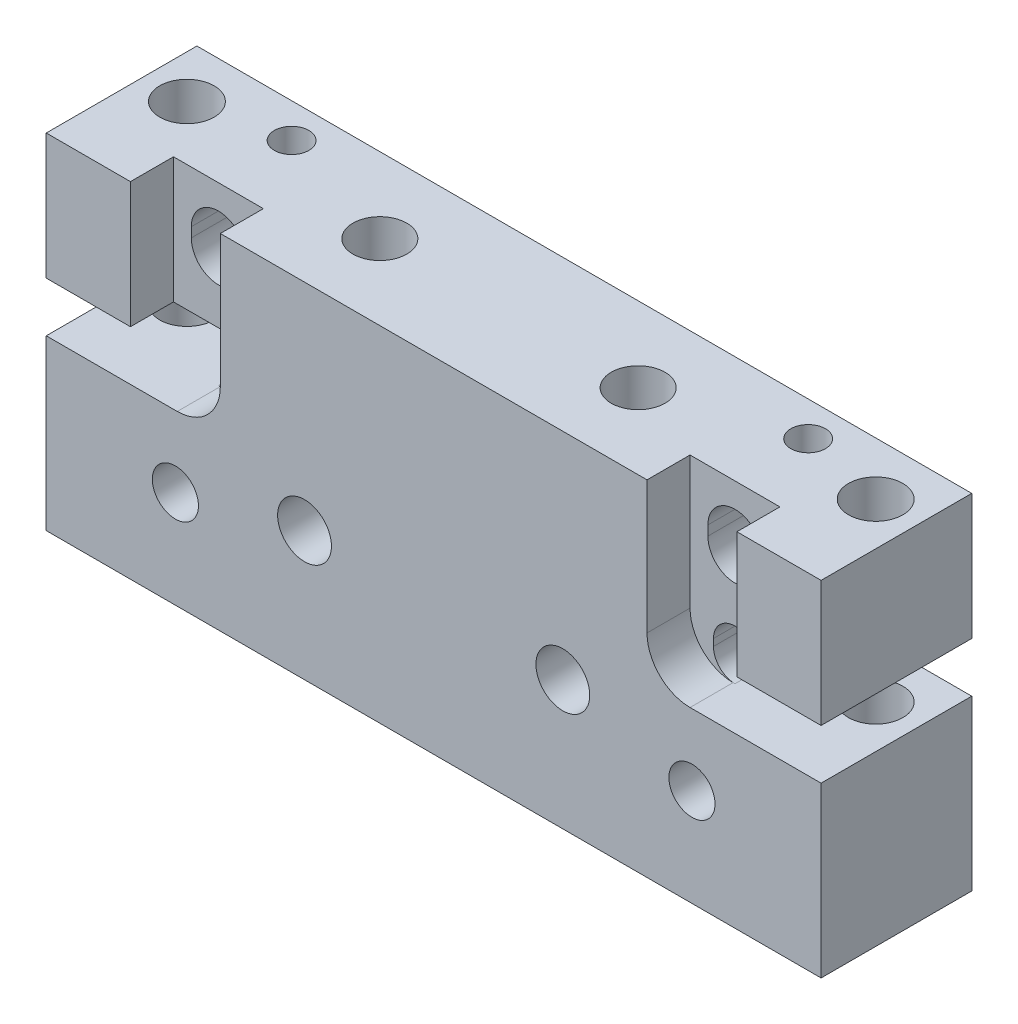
SolidWorks part; units mm, degrees
ref_plane "Front Plane" through (0, 0, 0) normal (0, 0, 1) x (1, 0, 0)
ref_plane "Top Plane" through (0, 0, 0) normal (0, 1, 0) x (1, 0, 0)
ref_plane "Right Plane" through (0, 0, 0) normal (1, 0, 0) x (0, 0, -1)
sketch "Sketch1" plane through (0, 0, 0) normal (0, 0, 1) x (1, 0, 0)
  line L1 (0, 0) -> (114.3, 0)
  line L2 (0, 0) -> (0, 50.8)
  line L3 (0, 50.8) -> (114.3, 50.8)
  line L4 (114.3, 0) -> (114.3, 50.8)
  dimension "D1" = 114.3
  dimension "D2" = 50.8
extrude "Extrude1" add sketch "Sketch1" along normal blind 22.225
ref_plane "Plane1" through (0, 31.75, 0) normal (0, -1, 0) x (1, 0, 0)
ref_plane "Plane2" through (0, 25.4, 0) normal (0, -1, 0) x (1, 0, 0)
sketch "Sketch2" plane through (0, 0, 22.225) normal (0, 0, 1) x (1, 0, 0)
  line L0 (57.15, 50.8) -> (57.15, 0) construction
  line L1 (114.3, 50.8) -> (0, 50.8) construction
  line L2 (0, 0) -> (114.3, 0) construction
  line L3 (17.2861, 28.575) -> (95.7792, 28.575) construction
  line L4 (-12.2238, 31.75) -> (12.2238, 31.75) construction
  line L5 (114.3, 0) -> (114.3, 50.8) construction
  line L6 (114.3, 32.258) -> (95.25, 32.258)
  line L7 (114.3, 32.258) -> (114.3, 24.892)
  line L8 (114.3, 24.892) -> (95.25, 24.892)
  line L9 (92.075, 29.083) -> (92.075, 28.067)
  line L10 (22.225, 29.083) -> (22.225, 28.067)
  line L11 (0, 24.892) -> (19.05, 24.892)
  line L12 (0, 32.258) -> (0, 24.892)
  line L13 (0, 32.258) -> (19.05, 32.258)
  arc A0 (22.225, 29.083) -> (19.05, 32.258) centre (19.05, 29.083) ccw
  arc A1 (19.05, 24.892) -> (22.225, 28.067) centre (19.05, 28.067) ccw
  arc A2 (92.075, 28.067) -> (95.25, 24.892) centre (95.25, 28.067) ccw
  arc A3 (92.075, 29.083) -> (95.25, 32.258) centre (95.25, 29.083) cw
  point P22 (22.225, 32.258)
  point P25 (22.225, 24.892)
  point P28 (92.075, 24.892)
  point P31 (92.075, 32.258)
  dimension "D4" = 3.175
  dimension "D5" = 3.175
  dimension "D1" = 3.175
  dimension "D2" = 7.366
  dimension "D3" = 22.225
extrude "Clearance Slot" cut sketch "Sketch2" against normal through all
hole_wizard "M8x1.25 Tapped Hole1" positions "Sketch5" profile "Sketch6" tap size "M8x1.25" standard "Ansi Metric"
sketch "Sketch5" plane through (0, 0, 22.225) normal (0, 0, 1) x (1, 0, 0)
  line L0 (57.15, 0) -> (57.15, 50.8) construction
  line L1 (0, 0) -> (114.3, 0) construction
  line L2 (114.3, 50.8) -> (0, 50.8) construction
  line L3 (-12.2238, 25.4) -> (12.2238, 25.4) construction
  point P0 (95.25, 14.4)
  point P12 (19.05, 14.4)
  dimension "D1" = 11
  dimension "D2" = 76.2
sketch "Sketch6" plane through (95.25, 14.4, 22.225) normal (1, 0, 0) x (0, -1, 0)
  line L0 (0, 0) -> (0, 22.225)
  line L1 (0, 22.225) -> (3.4, 22.225)
  line L2 (3.4, 22.225) -> (3.4, 0)
  line L5 (3.4, 0) -> (0, 0)
  line L11 (0, -6.35) -> (0, 107.95) construction
  dimension "Thru Tap Drill Dia." = 6.8
  dimension "Thru Tap Drill Depth" = 22.225
hole_wizard "3/8-16 Tapped Hole7" positions "Sketch8" profile "Sketch9" tap size "3/8-16" standard "Ansi Inch"
sketch "Sketch8" plane through (0, 0, 22.225) normal (0, 0, 1) x (1, 0, 0)
  line L0 (57.15, 0) -> (57.15, 50.8) construction
  line L1 (0, 0) -> (114.3, 0) construction
  line L2 (114.3, 50.8) -> (0, 50.8) construction
  point P0 (38.1, 19.05)
  point P11 (76.2, 19.05)
  dimension "D1" = 19.05
  dimension "D2" = 38.1
sketch "Sketch9" plane through (38.1, 19.05, 22.225) normal (1, 0, 0) x (0, -1, 0)
  line L0 (0, 0) -> (0, 22.225)
  line L1 (0, 22.225) -> (3.9687, 22.225)
  line L2 (3.9687, 22.225) -> (3.9687, 0)
  line L5 (3.9687, 0) -> (0, 0)
  line L11 (0, -6.35) -> (0, 107.95) construction
  dimension "Thru Tap Drill Dia." = 7.9375
  dimension "Thru Tap Drill Depth" = 22.225
sketch "Sketch10" plane through (0, 0, 22.225) normal (0, 0, 1) x (1, 0, 0)
  line L0 (-12.2238, 31.75) -> (12.2238, 31.75) construction
  line L1 (57.15, 50.8) -> (57.15, 0) construction
  line L2 (114.3, 50.8) -> (0, 50.8) construction
  line L3 (0, 0) -> (114.3, 0) construction
  line L4 (99.25, 41.75) -> (99.25, 43.18)
  line L5 (91.25, 41.75) -> (91.25, 43.18)
  line L6 (23.05, 41.75) -> (23.05, 43.18)
  line L7 (15.05, 41.75) -> (15.05, 43.18)
  arc A0 (91.25, 41.75) -> (99.25, 41.75) centre (95.25, 41.75) ccw
  arc A1 (15.05, 43.18) -> (23.05, 43.18) centre (19.05, 43.18) cw
  arc A2 (99.25, 43.18) -> (91.25, 43.18) centre (95.25, 43.18) ccw
  arc A3 (23.05, 41.75) -> (15.05, 41.75) centre (19.05, 41.75) cw
  dimension "D1" = 8
  dimension "D2" = 10
  dimension "D4" = 7.62
extrude "Cut-Extrude2" cut sketch "Sketch10" against normal through all
sketch "Sketch11" plane through (0, 0, 22.225) normal (0, 0, 1) x (1, 0, 0)
  line L0 (95.25, 37.75) -> (95.25, 64.3489) construction
  line L1 (57.15, 50.8) -> (57.15, 0) construction
  line L2 (114.3, 50.8) -> (0, 50.8) construction
  line L3 (0, 0) -> (114.3, 0) construction
  line L5 (88.6206, 50.8) -> (101.8794, 50.8)
  line L6 (88.6206, 50.8) -> (88.6206, 31.242)
  line L7 (94.9706, 24.892) -> (101.8794, 24.892)
  line L8 (101.8794, 50.8) -> (101.8794, 24.892)
  line L9 (12.4206, 50.8) -> (12.4206, 24.892)
  line L10 (19.3294, 24.892) -> (12.4206, 24.892)
  line L11 (25.6794, 50.8) -> (25.6794, 31.242)
  line L12 (25.6794, 50.8) -> (12.4206, 50.8)
  line L13 (95.25, 24.892) -> (114.3, 24.892) construction
  arc A0 (91.25, 41.75) -> (99.25, 41.75) centre (95.25, 41.75) ccw construction
  arc A1 (88.6206, 31.242) -> (94.9706, 24.892) centre (94.9706, 31.242) ccw
  arc A2 (25.6794, 31.242) -> (19.3294, 24.892) centre (19.3294, 31.242) cw
  point P24 (88.6206, 24.892)
  dimension "D2" = 6.35
  dimension "D1" = 13.2588
extrude "Cut-Extrude3" cut sketch "Sketch11" against normal blind 6.35
hole_wizard "3/8-16 Tapped Hole6" positions "Sketch16" profile "Sketch17" tap size "3/8-16" standard "Ansi Inch"
sketch "Sketch16" plane through (0, 50.8, 0) normal (0, 1, 0) x (-1, 0, 0)
  line L0 (-114.3, 11.1125) -> (0, 11.1125) construction
  line L1 (-114.3, 22.225) -> (-114.3, 0) construction
  line L2 (0, 22.225) -> (0, 0) construction
  line L3 (-57.15, 22.225) -> (-57.15, 0) construction
  line L4 (-88.6206, 22.225) -> (-25.6794, 22.225) construction
  line L5 (-114.3, 0) -> (0, 0) construction
  point P0 (-76.2, 11.1125)
  point P16 (-38.1, 11.1125)
  dimension "D1" = 38.1
sketch "Sketch17" plane through (76.2, 50.8, 11.1125) normal (1, 0, 0) x (0, 0, 1)
  line L0 (0, 0) -> (0, 50.8)
  line L1 (0, 50.8) -> (3.9687, 50.8)
  line L2 (3.9687, 50.8) -> (3.9687, 0)
  line L5 (3.9687, 0) -> (0, 0)
  line L11 (0, -6.35) -> (0, 107.95) construction
  dimension "Thru Tap Drill Dia." = 7.9375
  dimension "Thru Tap Drill Depth" = 50.8
hole_wizard "1/4-20 Tapped Hole1" positions "Sketch21" profile "Sketch20" tap size "1/4-20" standard "Ansi Inch"
sketch "Sketch21" plane through (0, 50.8, 0) normal (0, 1, 0) x (-1, 0, 0)
  line L0 (-95.25, 15.875) -> (-95.25, 0) construction
  line L1 (-101.8794, 15.875) -> (-88.6206, 15.875) construction
  line L2 (-114.3, 0) -> (0, 0) construction
  line L3 (-57.15, 0) -> (-57.15, 52.8145) construction
  point P0 (-95.25, 5.08)
  point P15 (-19.05, 5.08)
  dimension "D1" = 5.08
sketch "Sketch20" plane through (95.25, 50.8, 5.08) normal (1, 0, 0) x (0, 0, 1)
  line L0 (0, 0) -> (0, 3.62)
  line L1 (0, 3.62) -> (2.5527, 3.62)
  line L2 (2.5527, 3.62) -> (2.5527, 0)
  line L5 (2.5527, 0) -> (0, 0)
  line L11 (0, -6.35) -> (0, 107.95) construction
  dimension "Thru Tap Drill Dia." = 5.1054
  dimension "Thru Tap Drill Depth" = 3.62
hole_wizard "O (0.316) Diameter Hole3" positions "Sketch23" profile "Sketch22" hole size "O" standard "ANSI Inch"
sketch "Sketch23" plane through (0, 50.8, 0) normal (0, 1, 0) x (-1, 0, 0)
  line L0 (-114.3, 0) -> (0, 0) construction
  line L1 (0, 22.225) -> (0, 0) construction
  line L2 (-114.3, 22.225) -> (-114.3, 0) construction
  point P1 (-6.35, 7.8232)
  point P4 (-107.95, 7.8232)
  dimension "D1" = 7.8232
  dimension "D2" = 6.35
  dimension "D3" = 6.35
  dimension "D4" = 7.8232
sketch "Sketch22" plane through (6.35, 50.8, 7.8232) normal (1, 0, 0) x (0, 0, 1)
  line L0 (0, 0) -> (0, 50.8)
  line L1 (0, 50.8) -> (4.0132, 50.8)
  line L2 (4.0132, 50.8) -> (4.0132, 0)
  line L5 (4.0132, 0) -> (0, 0)
  line L11 (0, -6.35) -> (0, 107.95) construction
  dimension "Thru Hole Dia." = 8.0264
  dimension "Thru Hole Depth" = 50.8
